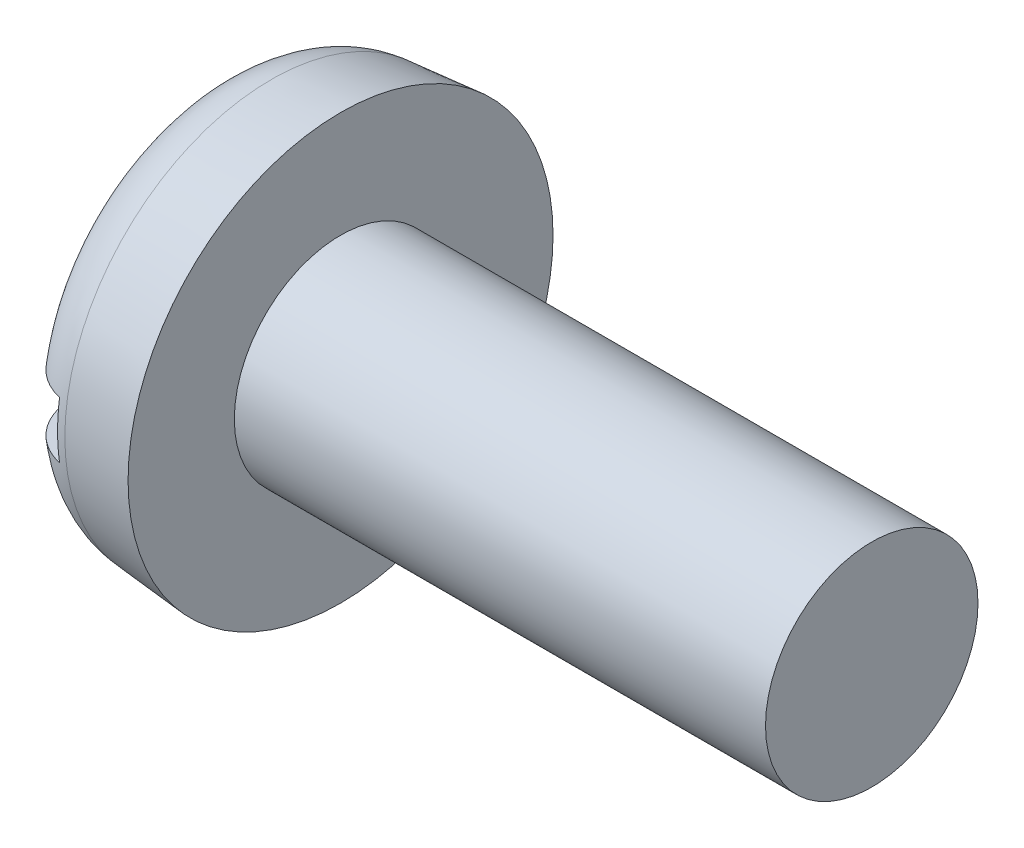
SolidWorks part; units mm, degrees
ref_plane "Plane1" through (0, 0, 0) normal (0, 0, 1) x (1, 0, 0)
ref_plane "Plane2" through (0, 0, 0) normal (0, 1, 0) x (1, 0, 0)
ref_plane "Plane3" through (0, 0, 0) normal (1, 0, 0) x (0, 0, -1)
sketch "BodySke" plane through (0, 0, 0) normal (0, 0, 1) x (1, 0, 0)
  line L0 (3.6, 3) -> (3.6, 6)
  line L1 (0, 0) -> (0, 5.685)
  line L2 (-25.4, 0) -> (127, 0) construction
  line L3 (18.6, 0) -> (0, 0)
  line L4 (3.6, 3) -> (18.6, 3)
  line L5 (18.6, 3) -> (18.6, 0)
  line L6 (0, 5.685) -> (3.6, 6)
  line L9 (4.6, 4.5875) -> (4.6, -4.9375) construction
  line L10 (3.6, 6.35) -> (3.6, -3.175) construction
  dimension "Head_ht" = 3.6
  dimension "Diameter" = 6
  dimension "Length" = 15
  dimension "Head_dia" = 12
  dimension "Advance" = 1
  dimension "Thread_nom" = 15
  dimension "Head_side_angle" = 5
revolve "Base-Revolve" add sketch "BodySke"
fillet "Fillet1" [suppressed] radius 0.25
fillet "Fillet2" radius 1.8 1 edges at (0, 0, 5.685)
sketch "Sketch2" plane through (0, 0, 0) normal (1, 0, 0) x (0, 0, -1)
  line L0 (6, -0.8) -> (-6, -0.8)
  line L1 (6, -0.8) -> (6, 0.8)
  line L2 (-6, 0.8) -> (6, 0.8)
  line L3 (-6, 0.8) -> (-6, -0.8)
  dimension "D1" = 12
  dimension "D2" = 6
  dimension "Slot_width" = 1.6
  dimension "D3" = 0.8
extrude "Slot" cut sketch "Sketch2" along normal blind 1.4
sketch "ThdSchSke" plane through (0, 0, 0) normal (0, 0, 1) x (1, 0, 0)
  line L0 (5.6, -2.4455) -> (5.2117, -3)
  line L1 (5.6, -2.4455) -> (5.9883, -3)
  line L2 (5.9883, -3) -> (5.9883, -3.75)
  line L3 (-3.175, 0) -> (5.1513, 0) construction
  line L5 (5.9883, -3.75) -> (5.2117, -3.75)
  line L6 (5.2117, -3.75) -> (5.2117, -3)
  dimension "Thread_minor" = 4.891
  dimension "Diameter" = 6
  dimension "Start" = 5.6
  dimension "SideAngle" = 55
  dimension "VeeAngle" = 70
  dimension "Overcut" = 7.5
revolve "ThreadSchematic" [suppressed] cut sketch "ThdSchSke" angle 360 about L3
pattern_linear "ThdSchPat" [suppressed]
equation "\"D1@Sketch2\" = \"Head_dia@BodySke\""
equation "\"D2@Sketch2\" = \"D1@Sketch2\" / 2"
equation "\"D3@Sketch2\" = \"Slot_width@Sketch2\" / 2"
equation "\"Thread_length@ThreadCosmetic\" = ((sgn( (\"Length@BodySke\" - \"Advance@BodySke\" * 2.0 ) - \"Thread_nom@BodySke\" )-1)*( (\"Length@BodySke\" - \"Advance@BodySke\"  * 2.0) - \"Thread_nom@BodySke\" ))/-2+ \"Thread_"
equation "\"Thread_minor@ThdSchSke\" = \"Thread_minor@ThreadCosmetic\""
equation "\"Diameter@ThdSchSke\" = \"Diameter@BodySke\""
equation "\"Overcut@ThdSchSke\" = \"Diameter@BodySke\" * 1.25"
equation "\"Start@ThdSchSke\" = \"Head_ht@BodySke\" + \"Length@BodySke\" - \"Thread_length@ThreadCosmetic\"  '---Non-countersunk---"
equation "\"Num_threads@ThdSchPat\" = int( \"Thread_length@ThreadCosmetic\" / \"Advance@BodySke\" + 0.999 )  + 1"
equation "\"Advance@ThdSchPat\" = \"Thread_length@ThreadCosmetic\" /  (\"Num_threads@ThdSchPat\" - 1) 'relax it"
